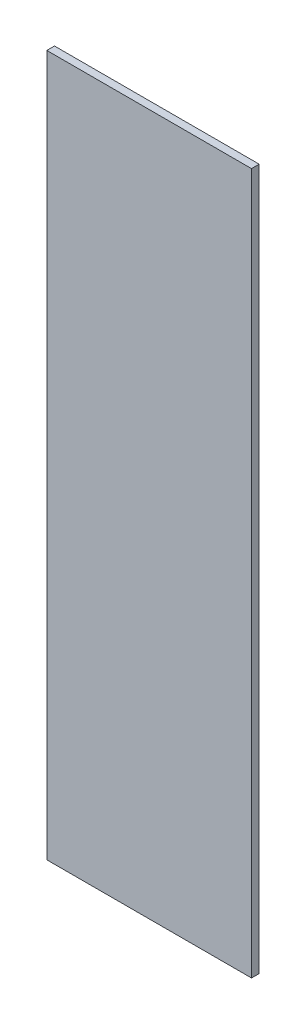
SolidWorks part; units mm, degrees
ref_plane "Alzado" through (0, 0, 0) normal (0, 0, 1) x (1, 0, 0)
ref_plane "Planta" through (0, 0, 0) normal (0, 1, 0) x (1, 0, 0)
ref_plane "Vista lateral" through (0, 0, 0) normal (1, 0, 0) x (0, 0, -1)
sketch "Croquis1" plane through (0, 0, 0) normal (0, 0, 1) x (1, 0, 0)
  line L1 (-200, 685) -> (200, 685)
  line L2 (-200, 685) -> (-200, -685)
  line L3 (-200, -685) -> (200, -685)
  line L4 (200, 685) -> (200, -685)
  line L5 (-200, 685) -> (200, -685) construction
  line L6 (-200, -685) -> (200, 685) construction
  point P0 (0, 0)
  dimension "D1" = 400
  dimension "D2" = 1370
extrude "Saliente-Extruir1" add sketch "Croquis1" along normal blind 15
